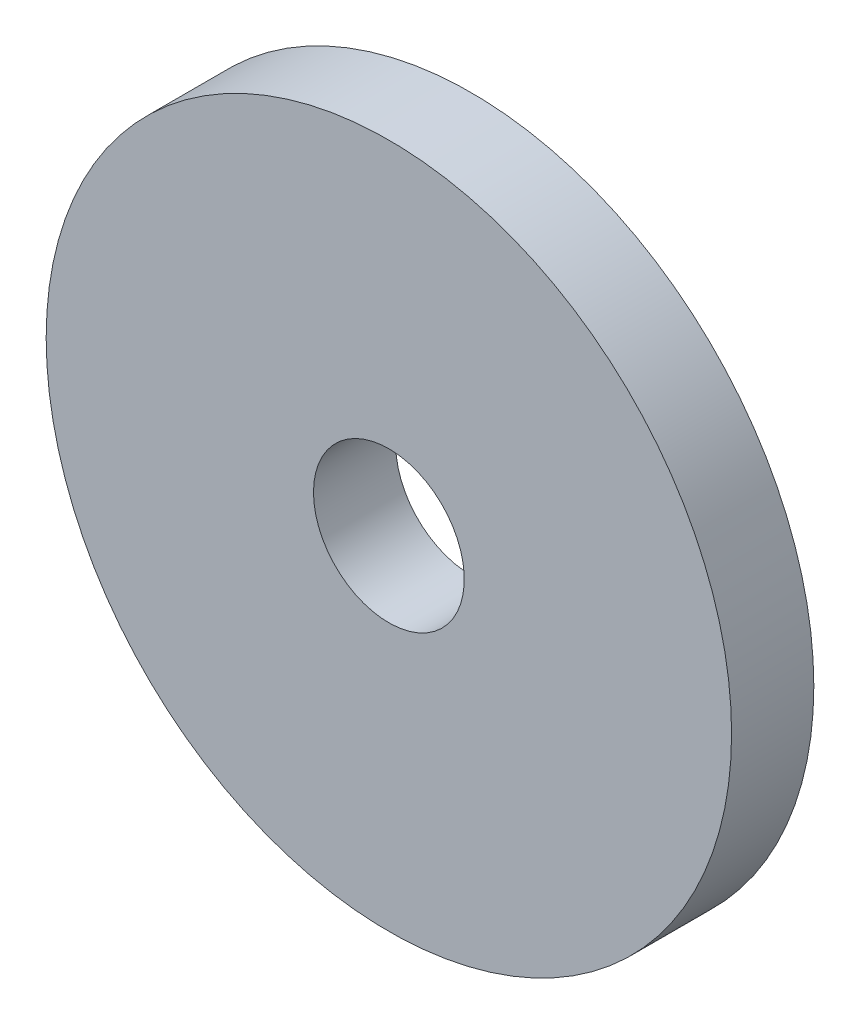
SolidWorks part; units mm, degrees
ref_plane "Front Plane" through (0, 0, 0) normal (0, 0, 1) x (1, 0, 0)
ref_plane "Top Plane" through (0, 0, 0) normal (0, 1, 0) x (1, 0, 0)
ref_plane "Right Plane" through (0, 0, 0) normal (1, 0, 0) x (0, 0, -1)
sketch "Sketch1" plane through (0, 0, 0) normal (0, 0, 1) x (1, 0, 0)
  circle A0 centre (0, 0) radius 3.175
  circle A1 centre (0, 0) radius 0.6985 construction
  dimension "D1" = 1.397
  dimension "D2" = 6.35
extrude "Boss-Extrude1" add sketch "Sketch1" along normal blind 0.762
sketch "Sketch2" plane through (0, 0, 0) normal (0, 0, 1) x (1, 0, 0)
  circle A0 centre (0, 0) radius 0.6985 construction
  circle A1 centre (0, 0) radius 0.6985
extrude "Cut-Extrude2" cut sketch "Sketch2" along normal through all
equation "\"Buoyancy\"=\"SW-Volume\"*(\"SW-Density\"-.037062)"
